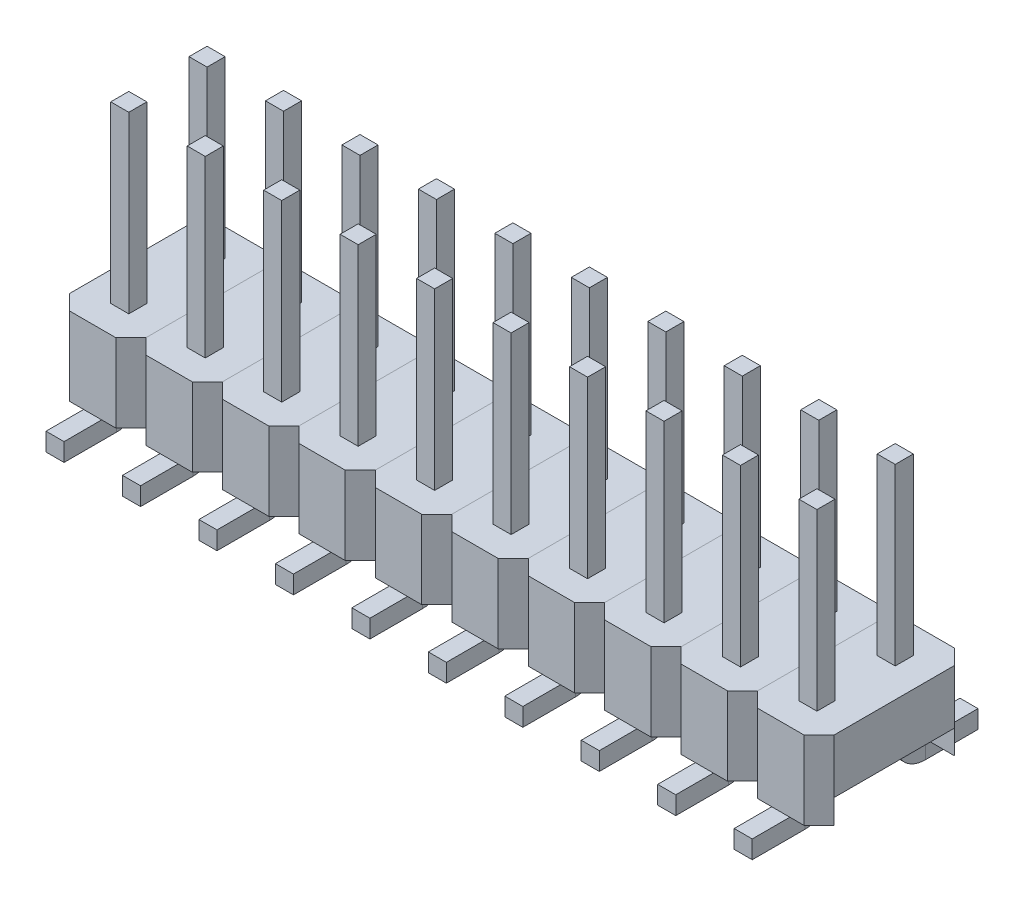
SolidWorks part; units mm, degrees
ref_plane "Front Plane" through (0, 0, 0) normal (0, 0, 1) x (1, 0, 0)
ref_plane "Top Plane" through (0, 0, 0) normal (0, 1, 0) x (1, 0, 0)
ref_plane "Right Plane" through (0, 0, 0) normal (1, 0, 0) x (0, 0, -1)
sketch "Sketch1" plane through (0, 0, 0) normal (0, 1, 0) x (1, 0, 0)
  line L1 (-1.27, 2.5) -> (1.27, 2.5)
  line L2 (-1.27, 2.5) -> (-1.27, -2.5)
  line L3 (-1.27, -2.5) -> (1.27, -2.5)
  line L4 (1.27, 2.5) -> (1.27, -2.5)
  line L5 (-1.27, 2.5) -> (1.27, -2.5) construction
  line L6 (-1.27, -2.5) -> (1.27, 2.5) construction
  point P0 (0, 0)
  dimension "D1" = 5
  dimension "D2" = 2.54
extrude "Boss-Extrude1" add sketch "Sketch1" along normal blind 2.6
chamfer "Chamfer1" distance 0.5 angle 45 4 edges at (-1.27, 1.3, -2.5) (1.27, 1.3, -2.5) (-1.27, 1.3, 2.5) (1.27, 1.3, 2.5)
sketch "Sketch2" plane through (0, 2.6, 0) normal (0, 1, 0) x (1, 0, 0)
  line L0 (0, 1.6) -> (0, 2.5) construction
  line L1 (-0.3, 1.6) -> (0.3, 1.6)
  line L2 (-0.3, 1.6) -> (-0.3, 1)
  line L3 (-0.3, 1) -> (0.3, 1)
  line L4 (0.3, 1.6) -> (0.3, 1)
  line L5 (-0.3, -1) -> (0.3, -1)
  line L6 (-0.3, -1) -> (-0.3, -1.6)
  line L7 (-0.3, -1.6) -> (0.3, -1.6)
  line L8 (0.3, -1) -> (0.3, -1.6)
  line L9 (0.77, 2.5) -> (-0.77, 2.5) construction
  line L10 (0, -1.6) -> (0, -2.5) construction
  line L11 (-0.77, -2.5) -> (0.77, -2.5) construction
  point P8 (0, -1.6)
  dimension "D1" = 0.6
  dimension "D2" = 3.2
extrude "Cut-Extrude1" cut sketch "Sketch2" against normal up to next
sketch "Sketch3" plane through (1.27, 0, 0) normal (1, 0, 0) x (0, 0, -1)
  line L0 (-2, 0) -> (2, 0) construction
  line L1 (-2, 0) -> (2, 0)
  line L2 (-2, 0) -> (-2, 0.8)
  line L3 (-2, 0.8) -> (2, 0.8)
  line L4 (2, 0) -> (2, 0.8)
  line L5 (-2, 2.6) -> (2, 2.6) construction
  line L6 (2.5, 2.6) -> (2.5, 0) construction
  line L7 (-2.5, 0) -> (-2.5, 2.6) construction
  dimension "D1" = 1.8
  dimension "D2" = 0.5
  dimension "D3" = 0.5
extrude "Cut-Extrude2" cut sketch "Sketch3" against normal up to next
sketch "Sketch4" plane through (0, 2.6, 0) normal (0, 1, 0) x (1, 0, 0)
  line L1 (-0.3, -1.6) -> (0.3, -1.6)
  line L2 (-0.3, -1.6) -> (-0.3, -1)
  line L3 (-0.3, -1) -> (0.3, -1)
  line L4 (0.3, -1.6) -> (0.3, -1)
  line L5 (-0.3, 1) -> (0.3, 1)
  line L6 (-0.3, 1) -> (-0.3, 1.6)
  line L7 (-0.3, 1.6) -> (0.3, 1.6)
  line L8 (0.3, 1) -> (0.3, 1.6)
extrude "Boss-Extrude2" add sketch "Sketch4" along normal offset from surface (5.8 mm away) 8.4 separate body
sketch "Sketch5" plane through (0, 2.6, 0) normal (0, -1, 0) x (1, 0, 0)
  line L4 (-0.3, -1) -> (-0.3, -1.6)
  line L5 (-0.3, -1.6) -> (0.3, -1.6)
  line L6 (0.3, -1.6) -> (0.3, -1)
  line L7 (0.3, -1) -> (-0.3, -1)
  line L8 (-0.3, -1) -> (-0.3, -1.6)
  line L9 (-0.3, -1.6) -> (0.3, -1.6)
  line L10 (0.3, -1.6) -> (0.3, -1)
  line L11 (0.3, -1) -> (-0.3, -1)
  dimension "D1" = 0
sketch "Sketch7" plane through (-0.3, 0, 0) normal (1, 0, 0) x (0, 0, -1)
  line L0 (1.6, 2.6) -> (1.6, 0.4)
  line L2 (2.5, 0) -> (2, 0) construction
  line L3 (2, 0) -> (2, 0.8) construction
  line L4 (2, 0) -> (3.75, 0)
  line L5 (3.75, 0) -> (-3.75, 0) construction
  line L6 (0, 0) -> (0, 0.8) construction
  line L7 (2, 0.8) -> (-2, 0.8) construction
  arc A0 (1.6, 0.4) -> (2, 0) centre (2, 0.4) ccw
  dimension "D1" = 7.5
sweep "Sweep1" add profiles "Sketch5" path "Sketch7"
sketch "Sketch10" plane through (-0.3, 0, 0) normal (1, 0, 0) x (0, 0, -1)
  line L0 (1.6, 2.6) -> (1.6, 0.4) construction
  line L1 (2, 0) -> (3.75, 0) construction
  line L2 (1.6, 2.6) -> (1.6, 0.4)
  line L3 (2, 0) -> (3.75, 0)
  line L4 (0, 0) -> (0, 0.8) construction
  line L5 (0, 0) -> (0, 0.8)
  line L6 (-2, 0) -> (-3.75, 0)
  line L7 (-1.6, 2.6) -> (-1.6, 0.4)
  arc A0 (1.6, 0.4) -> (2, 0) centre (2, 0.4) ccw construction
  arc A1 (1.6, 0.4) -> (2, 0) centre (2, 0.4) ccw
  arc A2 (-1.6, 0.4) -> (-2, 0) centre (-2, 0.4) cw
sketch "Sketch11" plane through (0, 2.6, 0) normal (0, -1, 0) x (1, 0, 0)
  line L4 (-0.3, 1.6) -> (-0.3, 1)
  line L5 (-0.3, 1) -> (0.3, 1)
  line L6 (0.3, 1) -> (0.3, 1.6)
  line L7 (0.3, 1.6) -> (-0.3, 1.6)
  line L8 (-0.3, 1.6) -> (-0.3, 1)
  line L9 (-0.3, 1) -> (0.3, 1)
  line L10 (0.3, 1) -> (0.3, 1.6)
  line L11 (0.3, 1.6) -> (-0.3, 1.6)
  dimension "D1" = 0
sweep "Sweep2" add profiles "Sketch11" path "Sketch10"
pattern_linear "LPattern1" count 10 spacing 2.54 along (1, 0, 0)
